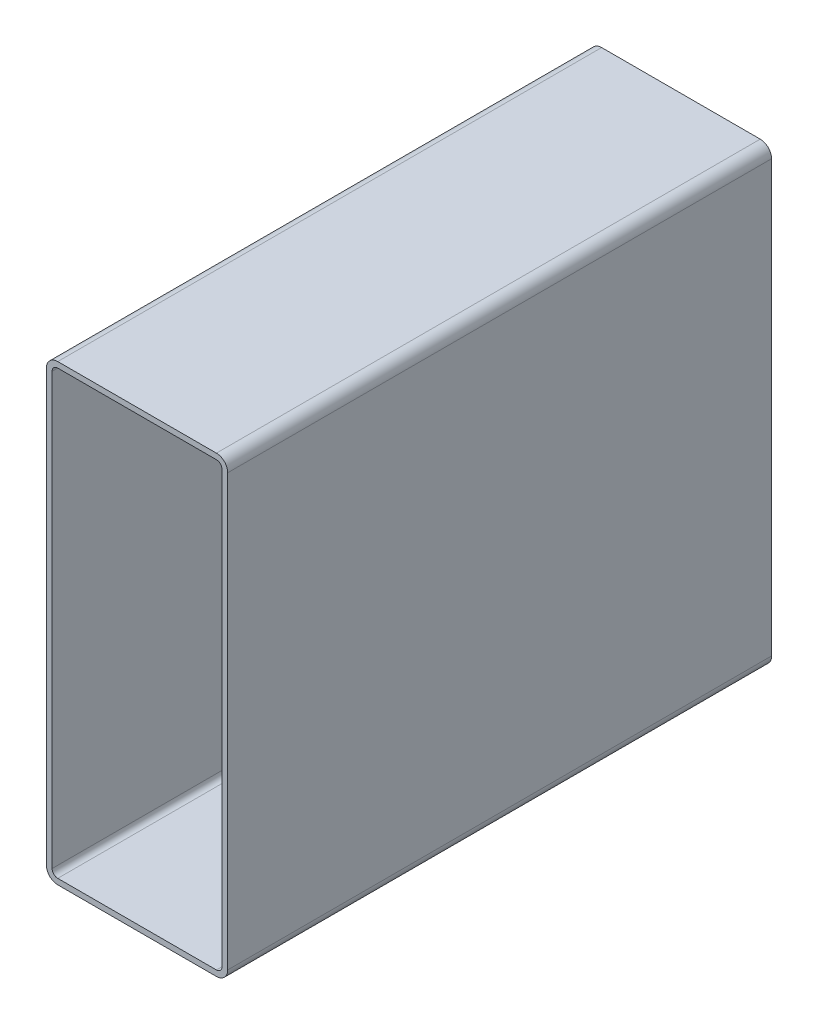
SolidWorks part; units mm, degrees
ref_plane "Front Plane" through (0, 0, 0) normal (0, 0, 1) x (1, 0, 0)
ref_plane "Top Plane" through (0, 0, 0) normal (0, 1, 0) x (1, 0, 0)
ref_plane "Right Plane" through (0, 0, 0) normal (1, 0, 0) x (0, 0, -1)
sketch "Sketch1" plane through (0, 0, 0) normal (0, 0, 1) x (1, 0, 0)
sketch_block_instance "HSS10x4x0.125-1"
sketch_block "HSS10x4x0.125"
extrude "Boss-Extrude1" add sketch "Sketch1" along normal blind 304.8
